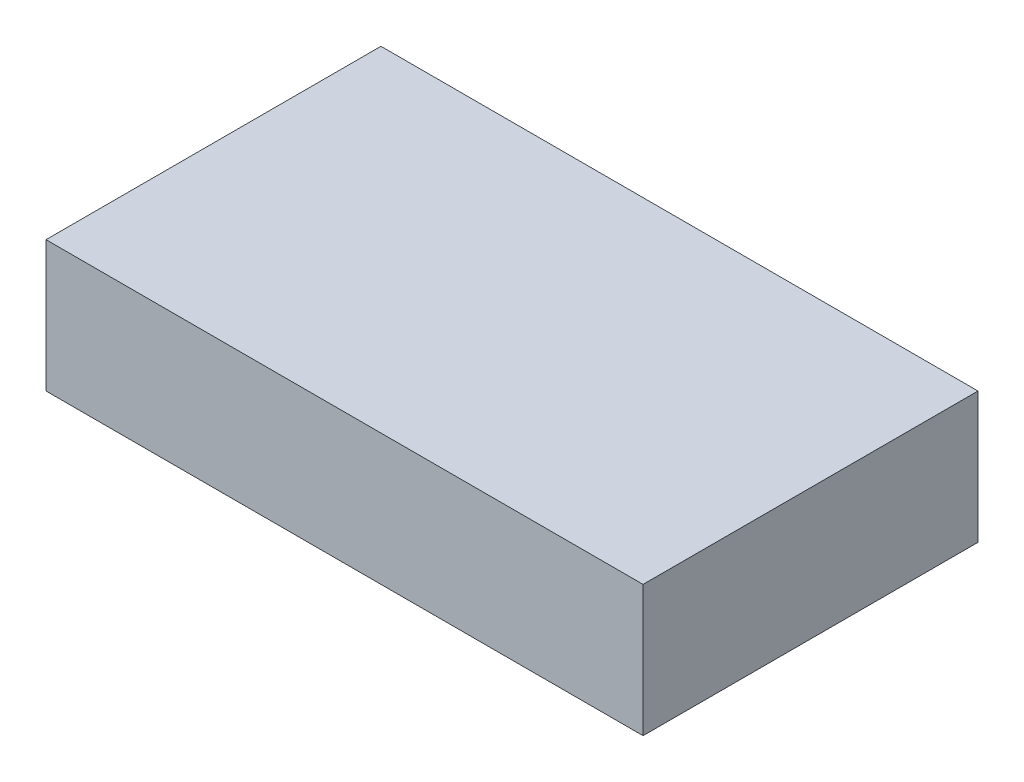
SolidWorks part; units mm, degrees
ref_plane "Front Plane" through (0, 0, 0) normal (0, 0, 1) x (1, 0, 0)
ref_plane "Top Plane" through (0, 0, 0) normal (0, 1, 0) x (1, 0, 0)
ref_plane "Right Plane" through (0, 0, 0) normal (1, 0, 0) x (0, 0, -1)
sketch "Sketch1" plane through (0, 0, 0) normal (0, 1, 0) x (1, 0, 0)
  line L1 (-41, 23) -> (41, 23)
  line L2 (-41, 23) -> (-41, -23)
  line L3 (-41, -23) -> (41, -23)
  line L4 (41, 23) -> (41, -23)
  line L5 (-41, 23) -> (41, -23) construction
  line L6 (-41, -23) -> (41, 23) construction
  point P0 (0, 0)
  dimension "D1" = 46
  dimension "D2" = 82
extrude "Boss-Extrude1" add sketch "Sketch1" along normal blind 18
